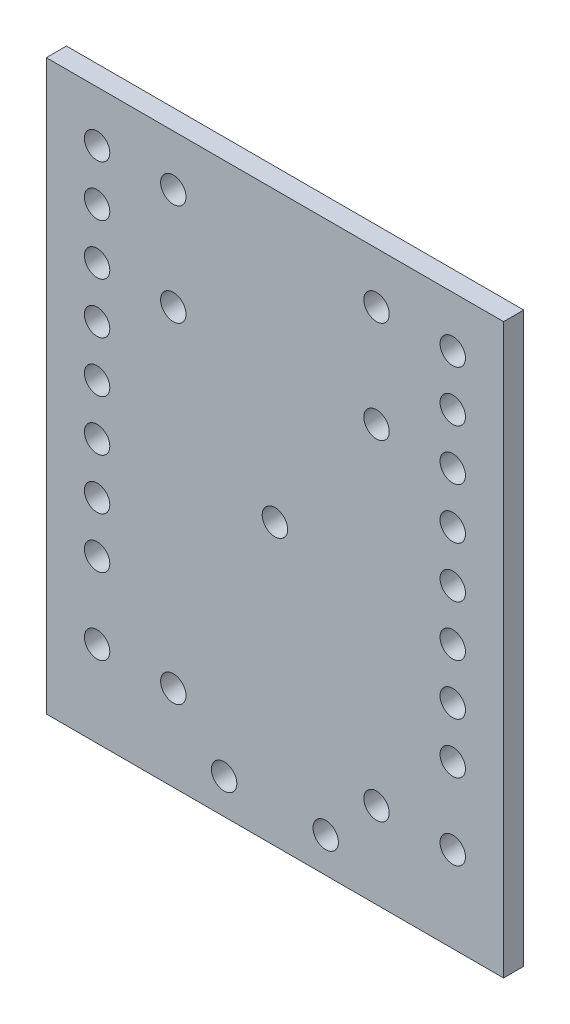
SolidWorks part; units mm, degrees
ref_plane "Front Plane" through (0, 0, 0) normal (0, 0, 1) x (1, 0, 0)
ref_plane "Top Plane" through (0, 0, 0) normal (0, 1, 0) x (1, 0, 0)
ref_plane "Right Plane" through (0, 0, 0) normal (1, 0, 0) x (0, 0, -1)
sketch "Sketch1" plane through (0, 0, 0) normal (0, 0, 1) x (1, 0, 0)
  line L1 (-36, -36) -> (36, -36)
  line L2 (-36, -36) -> (-36, 36)
  line L3 (-36, 36) -> (36, 36)
  line L4 (36, -36) -> (36, 36)
  line L5 (-36, -36) -> (36, 36) construction
  line L6 (-36, 36) -> (36, -36) construction
  point P0 (0, 0)
  dimension "D1" = 72
  dimension "D2" = 72
extrude "Boss-Extrude1" add sketch "Sketch1" along normal mid plane 3.175
sketch "Sketch2" plane through (0, 0, 0) normal (0, 0, 1) x (1, 0, 0)
  line L0 (36, 36) -> (-36, 36) construction
  line L1 (-36, 36) -> (-36, -36) construction
  circle A0 centre (-28, 28) radius 2
  circle A1 centre (-16, 28) radius 2
  circle A2 centre (-28, 20) radius 2
  circle A3 centre (-28, 12) radius 2
  circle A4 centre (-28, 4) radius 2
  circle A5 centre (-28, -4) radius 2
  circle A6 centre (-28, -12) radius 2
  circle A7 centre (-28, -20) radius 2
  circle A8 centre (-28, -28) radius 2
  circle A10 centre (-16, 12) radius 2
  dimension "D3" = 4
  dimension "D4" = 4
  dimension "D9" = 4
  dimension "D1" = 8
  dimension "D2" = 8
  dimension "D5" = 12
  dimension "D6" = 8
extrude "Cut-Extrude1" cut sketch "Sketch2" against normal through all both and the other way through all
sketch "Sketch3" plane through (0, 0, 0) normal (0, 0, 1) x (1, 0, 0)
  line L0 (-36, -36) -> (36, -36) construction
  circle A0 centre (0, -9.3422) radius 2
  dimension "D1" = 4
  dimension "D2" = 26.6578
extrude "Cut-Extrude2" cut sketch "Sketch3" against normal through all both and the other way through all
sketch "Sketch4" plane through (0, 0, 0) normal (0, 0, 1) x (1, 0, 0)
  line L0 (36, -36) -> (36, 36) construction
  line L1 (-36, -36) -> (36, -36)
  line L2 (-36, -36) -> (-36, -48)
  line L3 (-36, -48) -> (36, -48)
  line L4 (36, -36) -> (36, -48)
  dimension "D1" = 12
extrude "Boss-Extrude2" add sketch "Sketch4" along normal mid plane 3.175
sketch "Sketch6" plane through (0, 0, 0) normal (0, 0, 1) x (1, 0, 0)
  line L0 (-36, 36) -> (-36, -48) construction
  line L1 (-36, -48) -> (36, -48) construction
  line L2 (0, -1.7463) -> (0, 1.7463) construction
  circle A0 centre (-28, -40) radius 2
  circle A1 centre (28, -40) radius 2
  dimension "D1" = 4
  dimension "D2" = 8
  dimension "D3" = 8
extrude "Cut-Extrude4" cut sketch "Sketch6" against normal through all both and the other way through all
sketch "Sketch7" plane through (0, 0, 1.5875) normal (0, 0, 1) x (1, 0, 0)
  text T0 "NCSU" font "Gadugi" height 5
  dimension "D1" = 25
  dimension "D2" = 11.5
extrude "Cut-Extrude5" [suppressed] cut sketch "Sketch7" against normal blind 1
sketch "Sketch8" plane through (0, 0, 0) normal (0, 0, 1) x (1, 0, 0)
  line L0 (36, -48) -> (36, 36) construction
  line L1 (-36, -48) -> (36, -48)
  line L2 (-36, -48) -> (-36, -53.5)
  line L3 (-36, -53.5) -> (36, -53.5)
  line L4 (36, -48) -> (36, -53.5)
  dimension "D1" = 5.5
extrude "Boss-Extrude3" add sketch "Sketch8" along normal mid plane 3.175
sketch "Sketch9" plane through (0, 0, 1.5875) normal (0, 0, 1) x (1, 0, 0)
  line L0 (-36, -53.5) -> (36, -53.5) construction
  circle A0 centre (-8, -48) radius 2
  circle A1 centre (-16, -40) radius 2
  dimension "D1" = 4
  dimension "D4" = 4
  dimension "D2" = 5.5
  dimension "D3" = 8
  dimension "D5" = 8
  dimension "D6" = 8
extrude "Cut-Extrude6" cut sketch "Sketch9" against normal through all
mirror "Mirror1" about plane through (0, 0, 0) normal (1, 0, 0) of "Cut-Extrude6", "Cut-Extrude1"
